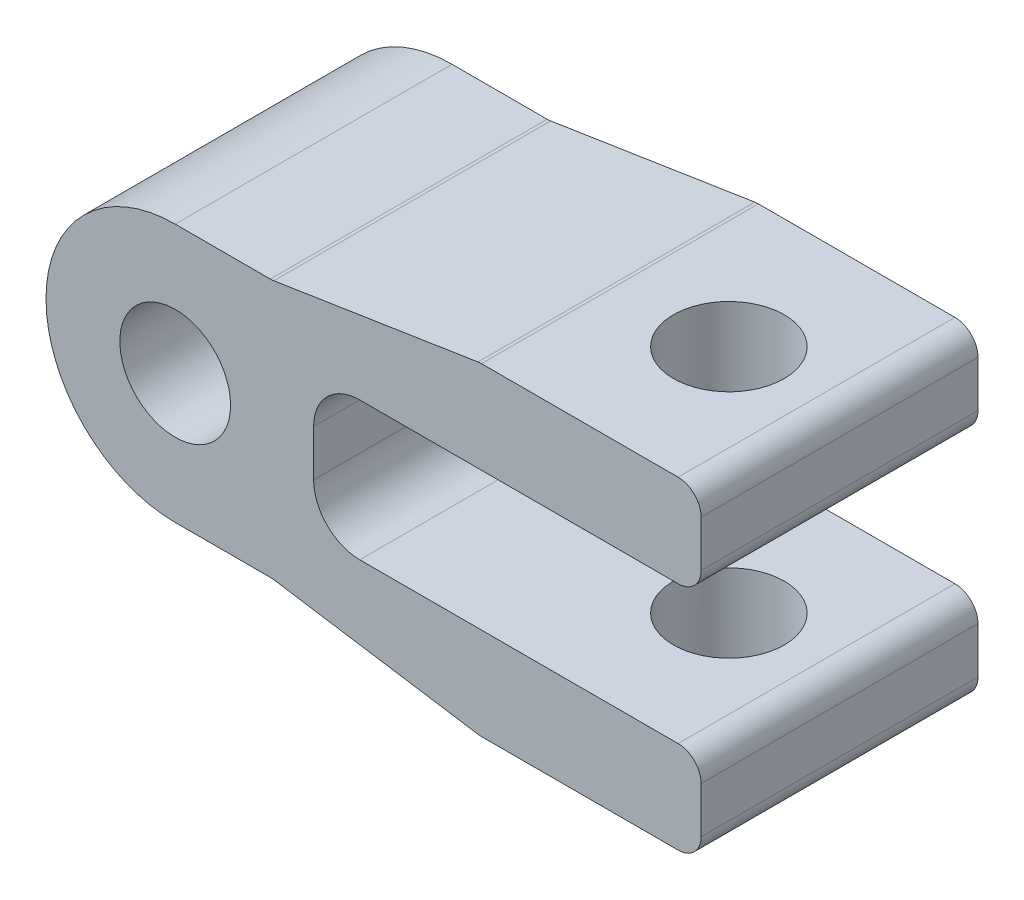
SolidWorks part; units mm, degrees
ref_plane "Plan1" through (0, 0, 0) normal (0, 0, 1) x (1, 0, 0)
ref_plane "Plan2" through (0, 0, 0) normal (0, 1, 0) x (1, 0, 0)
ref_plane "Plan3" through (0, 0, 0) normal (1, 0, 0) x (0, 0, -1)
sketch "Esquisse1" plane through (0, 0, 0) normal (0, 0, 1) x (1, 0, 0)
  line L0 (15, 2.5) -> (15, -2.5)
  line L1 (20, -7.5) -> (54.5, -7.5)
  line L2 (20, 7.5) -> (54.5, 7.5)
  line L3 (57, 10) -> (57, 15)
  line L4 (57, -10) -> (57, -15)
  line L5 (54.5, 17.5) -> (33.1933, 17.5)
  line L6 (54.5, -17.5) -> (33.1933, -17.5)
  line L7 (0, 14) -> (10.3067, 14)
  line L8 (0, -14) -> (10.3067, -14)
  line L9 (32.809, 17.4703) -> (10.691, 14.0297)
  line L10 (10.691, -14.0297) -> (32.809, -17.4703)
  arc A0 (0, 14) -> (0, -14) centre (0, 0) ccw
  circle A1 centre (0, 0) radius 6
  arc A2 (54.5, 17.5) -> (57, 15) centre (54.5, 15) cw
  arc A3 (57, 10) -> (54.5, 7.5) centre (54.5, 10) cw
  arc A4 (57, -10) -> (54.5, -7.5) centre (54.5, -10) ccw
  arc A5 (54.5, -17.5) -> (57, -15) centre (54.5, -15) ccw
  arc A6 (32.809, 17.4703) -> (33.1933, 17.5) centre (33.1933, 15) cw
  arc A7 (32.809, -17.4703) -> (33.1933, -17.5) centre (33.1933, -15) ccw
  arc A8 (10.691, 14.0297) -> (10.3067, 14) centre (10.3067, 16.5) cw
  arc A9 (10.691, -14.0297) -> (10.3067, -14) centre (10.3067, -16.5) ccw
  arc A10 (20, 7.5) -> (15, 2.5) centre (20, 2.5) ccw
  arc A11 (20, -7.5) -> (15, -2.5) centre (20, -2.5) cw
  point P17 (57, 17.5)
  point P20 (57, 7.5)
  point P23 (57, -7.5)
  point P26 (57, -17.5)
  point P29 (33, 17.5)
  point P32 (33, -17.5)
  point P35 (10.5, 14)
  point P38 (10.5, -14)
  point P41 (15, 7.5)
  point P44 (15, -7.5)
  dimension "D1" = 28
  dimension "D13" = 12
  dimension "D14" = 2.5
  dimension "D15" = 5
  dimension "D2" = 15
  dimension "D3" = 7.5
  dimension "D4" = 7.5
  dimension "D5" = 42
  dimension "D6" = 42
  dimension "D7" = 10
  dimension "D8" = 10
  dimension "D9" = 24
  dimension "D10" = 24
  dimension "D11" = 10.5
  dimension "D12" = 10.5
extrude "Base-Extrusion" add sketch "Esquisse1" along normal blind 30
sketch "Esquisse2" plane through (0, -17.5, 0) normal (0, -1, 0) x (1, 0, 0)
  circle A0 centre (45, 15) radius 6
  dimension "D3" = 12
  dimension "D1" = 45
  dimension "D2" = 15
extrude "Enlèv. mat.-Extru.1" cut sketch "Esquisse2" against normal through all
